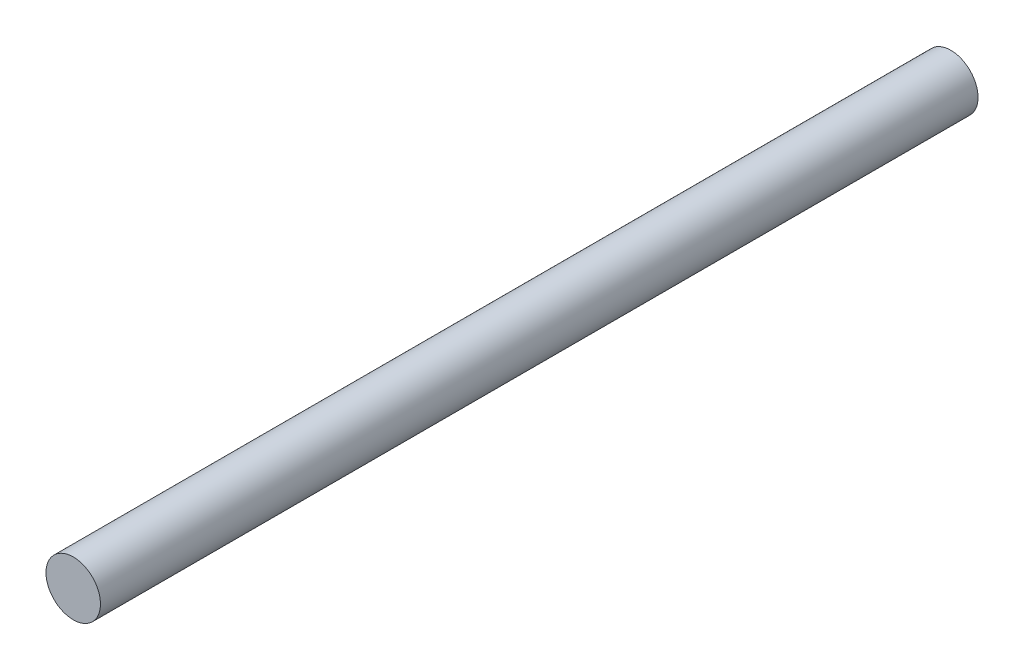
SolidWorks part; units mm, degrees
ref_plane "Ebene vorne" through (0, 0, 0) normal (0, 0, 1) x (1, 0, 0)
ref_plane "Ebene oben" through (0, 0, 0) normal (0, 1, 0) x (1, 0, 0)
ref_plane "Ebene rechts" through (0, 0, 0) normal (1, 0, 0) x (0, 0, -1)
sketch "Skizze1" plane through (0, 0, 0) normal (0, 0, 1) x (1, 0, 0)
  circle A0 centre (0, 0) radius 1.5
  dimension "D1" = 3
extrude "Aufsatz-Linear austragen1" add sketch "Skizze1" along normal blind 48.32
